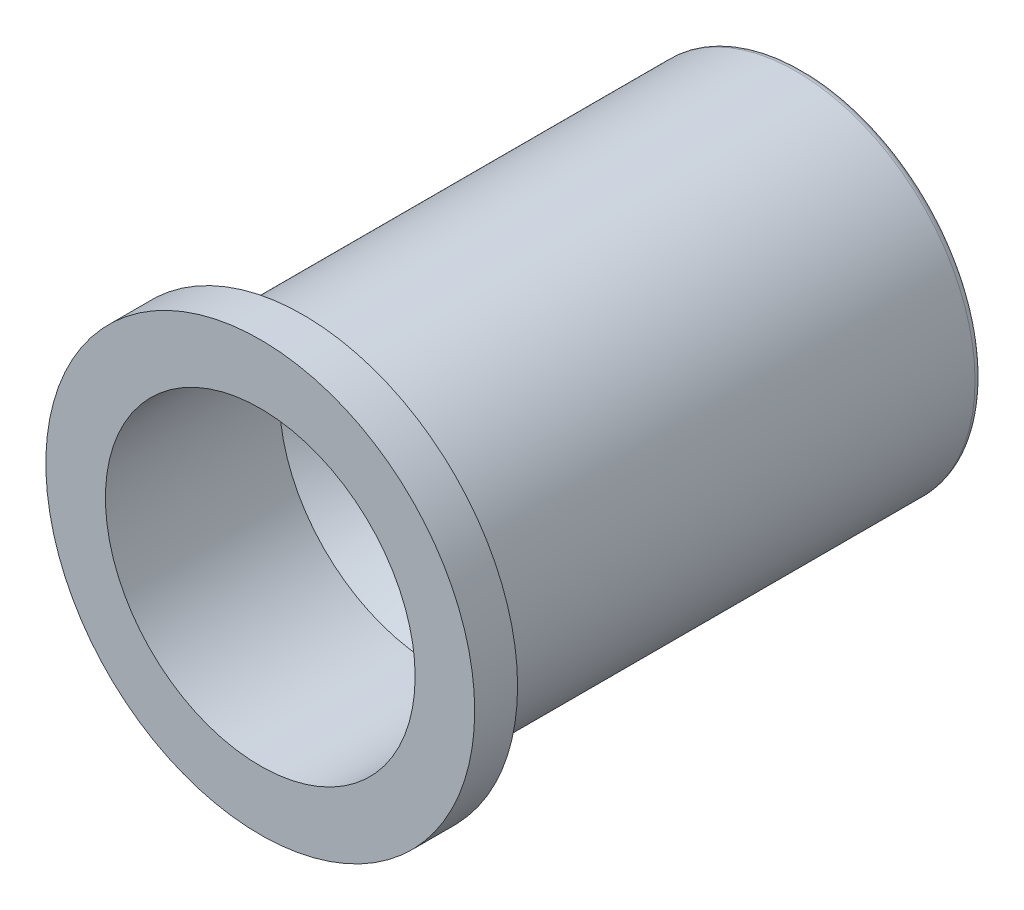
SolidWorks part; units mm, degrees
ref_plane "Front" through (0, 0, 0) normal (0, 0, 1) x (1, 0, 0)
ref_plane "Top" through (0, 0, 0) normal (0, 1, 0) x (1, 0, 0)
ref_plane "Right" through (0, 0, 0) normal (1, 0, 0) x (0, 0, -1)
sketch "Sketch3" plane through (0, 0, 0) normal (0, 0, 1) x (1, 0, 0)
  circle A0 centre (0, 0) radius 9
  dimension "dk" = 18
extrude "BaseHead" add sketch "Sketch3" against normal blind 1.8
sketch "Sketch4" plane through (-1.8728, 0.3563, -1.8) normal (0, 0, -1) x (-1, 0, 0)
  circle A0 centre (-1.8728, -0.3563) radius 7.5
  circle A1 centre (-1.8728, -0.3563) radius 9 construction
  dimension "d" = 15
extrude "BaseBody" add sketch "Sketch4" along normal blind 21
sketch "Sketch5" plane through (-1.3755, 3.4749, 0) normal (0, 0, 1) x (1, 0, 0)
  circle A0 centre (1.3755, -3.4749) radius 6.5
  circle A1 centre (1.3755, -3.4749) radius 9 construction
  dimension "d1" = 13
extrude "Hole1" cut sketch "Sketch5" against normal blind 7.3
sketch "Sketch6" plane through (0.0322, 0.3953, -7.3) normal (0, 0, 1) x (1, 0, 0)
  circle A0 centre (-0.0322, -0.3953) radius 5
  circle A1 centre (-0.0322, -0.3953) radius 6.5 construction
  dimension "D1" = 10
extrude "Hole2" cut sketch "Sketch6" against normal through all
fillet "Fillet1" radius 0.3 2 edges at (-7.5, 0, -22.8) (7.5, 0, -1.8)
chamfer "Chamfer1" distance 1.5 angle 45 1 edges at (5, 0, -7.3)
chamfer "Chamfer2" distance 0.5 angle 45 1 edges at (5, 0, -22.8)
sketch "Sketch7" plane through (0, 0, 0) normal (1, 0, 0) x (0, 0, -1)
  line L0 (28.4249, 0) -> (15.7466, 0) construction
  line L1 (21.8, -4) -> (22.8, -4)
  line L2 (22.8, -4) -> (22.8, -5)
  line L3 (22.8, -5) -> (22.3, -5.866)
  line L4 (22.3, -5.866) -> (21.8, -5)
  line L5 (21.8, -5) -> (21.8, -4)
  line L6 (22.3, 5) -> (22.3, -5) construction
  dimension "D1" = 10
  dimension "D2" = 1
revolve "Cut-Revolve10" [suppressed] cut sketch "Sketch7" angle 360 about L0
pattern_linear "LPattern10" [suppressed] count 12 spacing 1.2 along (0, 0, 1)
equation "\"D1@Chamfer1\" = (  \"d1@Sketch5\" - \"D1@Sketch6\" )  / 2"
equation "\"D1@Chamfer2\" = \"D1@Sketch6\" / 20"
equation "\"D1@Sketch7\" = \"D1@Sketch6\""
equation "\"D2@Sketch7\" = (  \"D2@ThreadCosmetic1\" - \"D1@Sketch6\" )  / 2"
equation "\"D3@LPattern10\" = \"D2@Sketch7\" * 1.2"
equation "\"D1@LPattern10\" =  ( \"l@BaseBody\" + \"k@BaseHead\"  - \"l1@Hole1\")  / \"D3@LPattern10\" - 1"
